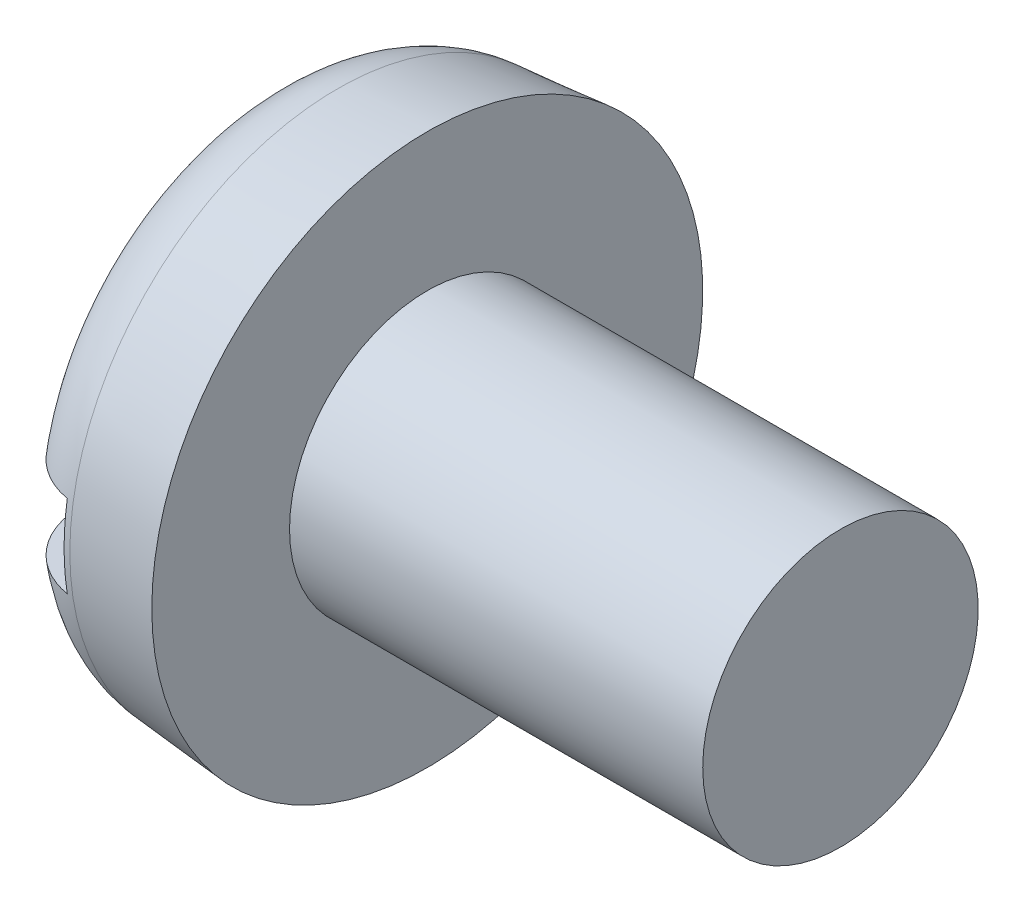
SolidWorks part; units mm, degrees
ref_plane "Plane1" through (0, 0, 0) normal (0, 0, 1) x (1, 0, 0)
ref_plane "Plane2" through (0, 0, 0) normal (0, 1, 0) x (1, 0, 0)
ref_plane "Plane3" through (0, 0, 0) normal (1, 0, 0) x (0, 0, -1)
sketch "BodySke" plane through (0, 0, 0) normal (0, 0, 1) x (1, 0, 0)
  line L0 (2.4, 2) -> (2.4, 4)
  line L1 (0, 0) -> (0, 3.79)
  line L2 (-25.4, 0) -> (127, 0) construction
  line L3 (8.4, 0) -> (0, 0)
  line L4 (2.4, 2) -> (8.4, 2)
  line L5 (8.4, 2) -> (8.4, 0)
  line L6 (0, 3.79) -> (2.4, 4)
  line L9 (3.1, 3.5875) -> (3.1, -5.9375) construction
  line L10 (2.4, 6.35) -> (2.4, -3.175) construction
  dimension "Head_ht" = 2.4
  dimension "Diameter" = 4
  dimension "Length" = 6
  dimension "Head_dia" = 8
  dimension "Advance" = 0.7
  dimension "Thread_nom" = 6
  dimension "Head_side_angle" = 5
revolve "Base-Revolve" add sketch "BodySke"
fillet "Fillet1" [suppressed] radius 0.2
fillet "Fillet2" radius 1.2 1 edges at (0, 0, 3.79)
sketch "Sketch2" plane through (0, 0, 0) normal (1, 0, 0) x (0, 0, -1)
  line L0 (4, -0.6) -> (-4, -0.6)
  line L1 (4, -0.6) -> (4, 0.6)
  line L2 (-4, 0.6) -> (4, 0.6)
  line L3 (-4, 0.6) -> (-4, -0.6)
  dimension "D1" = 8
  dimension "D2" = 4
  dimension "Slot_width" = 1.2
  dimension "D3" = 0.6
extrude "Slot" cut sketch "Sketch2" along normal blind 1
sketch "ThdSchSke" plane through (0, 0, 0) normal (0, 0, 1) x (1, 0, 0)
  line L0 (3.8, -1.61) -> (3.5269, -2)
  line L1 (3.8, -1.61) -> (4.0731, -2)
  line L2 (4.0731, -2) -> (4.0731, -2.5)
  line L3 (-3.175, 0) -> (5.1513, 0) construction
  line L5 (4.0731, -2.5) -> (3.5269, -2.5)
  line L6 (3.5269, -2.5) -> (3.5269, -2)
  dimension "Thread_minor" = 3.22
  dimension "Diameter" = 4
  dimension "Start" = 3.8
  dimension "SideAngle" = 55
  dimension "VeeAngle" = 70
  dimension "Overcut" = 5
revolve "ThreadSchematic" [suppressed] cut sketch "ThdSchSke" angle 360 about L3
pattern_linear "ThdSchPat" [suppressed]
equation "\"D1@Sketch2\" = \"Head_dia@BodySke\""
equation "\"D2@Sketch2\" = \"D1@Sketch2\" / 2"
equation "\"D3@Sketch2\" = \"Slot_width@Sketch2\" / 2"
equation "\"Thread_length@ThreadCosmetic\" = ((sgn( (\"Length@BodySke\" - \"Advance@BodySke\" * 2.0 ) - \"Thread_nom@BodySke\" )-1)*( (\"Length@BodySke\" - \"Advance@BodySke\"  * 2.0) - \"Thread_nom@BodySke\" ))/-2+ \"Thread_"
equation "\"Thread_minor@ThdSchSke\" = \"Thread_minor@ThreadCosmetic\""
equation "\"Diameter@ThdSchSke\" = \"Diameter@BodySke\""
equation "\"Overcut@ThdSchSke\" = \"Diameter@BodySke\" * 1.25"
equation "\"Start@ThdSchSke\" = \"Head_ht@BodySke\" + \"Length@BodySke\" - \"Thread_length@ThreadCosmetic\"  '---Non-countersunk---"
equation "\"Num_threads@ThdSchPat\" = int( \"Thread_length@ThreadCosmetic\" / \"Advance@BodySke\" + 0.999 )  + 1"
equation "\"Advance@ThdSchPat\" = \"Thread_length@ThreadCosmetic\" /  (\"Num_threads@ThdSchPat\" - 1) 'relax it"
